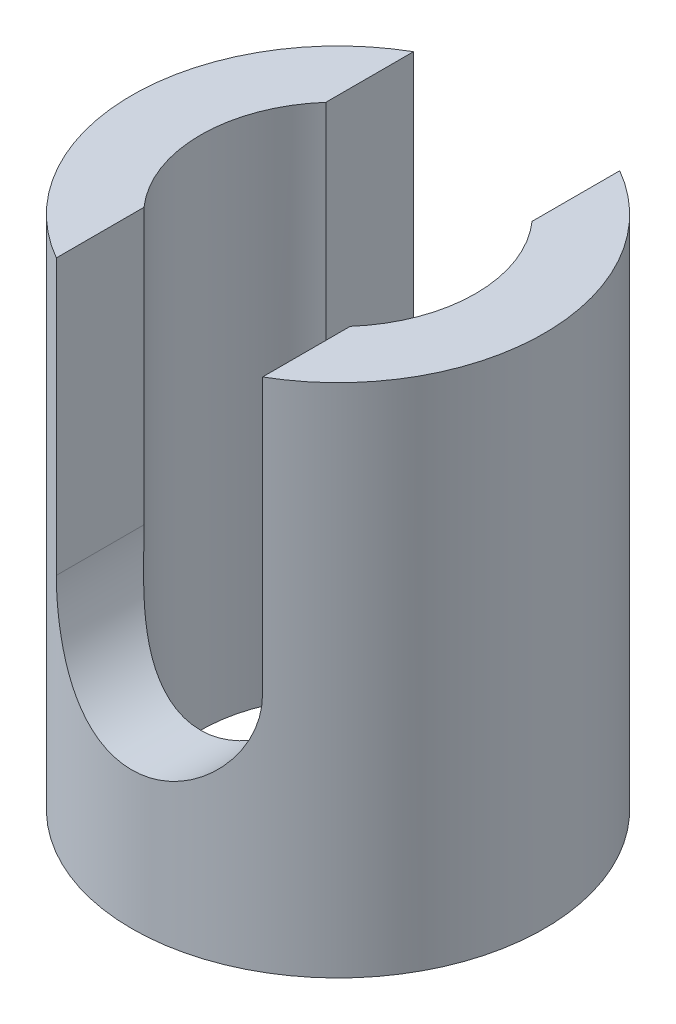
SolidWorks part; units mm, degrees
ref_plane "前视基准面" through (0, 0, 0) normal (0, 0, 1) x (1, 0, 0)
ref_plane "上视基准面" through (0, 0, 0) normal (0, 1, 0) x (1, 0, 0)
ref_plane "右视基准面" through (0, 0, 0) normal (1, 0, 0) x (0, 0, -1)
sketch "草图1" plane through (0, 0, 0) normal (0, 1, 0) x (1, 0, 0)
  circle A0 centre (0, 0) radius 30
  circle A1 centre (0, 0) radius 20
  dimension "D1" = 60
  dimension "D2" = 40
extrude "拉伸1" add sketch "草图1" along normal blind 75
sketch "草图4" plane through (0, 0, 0) normal (0, 0, 1) x (1, 0, 0)
  line L0 (0, 0) -> (0, 81.0401) construction
  line L1 (-15, 75) -> (-15, 35)
  line L2 (30, 75) -> (-30, 75) construction
  line L3 (15, 35) -> (15, 75)
  line L4 (20, 75) -> (-20, 75) construction
  line L5 (15, 75) -> (-15, 75)
  arc A0 (-15, 35) -> (15, 35) centre (0, 35) ccw
  dimension "D1" = 15
  dimension "D2" = 40
extrude "切除-拉伸2" cut sketch "草图4" against normal mid plane 90
